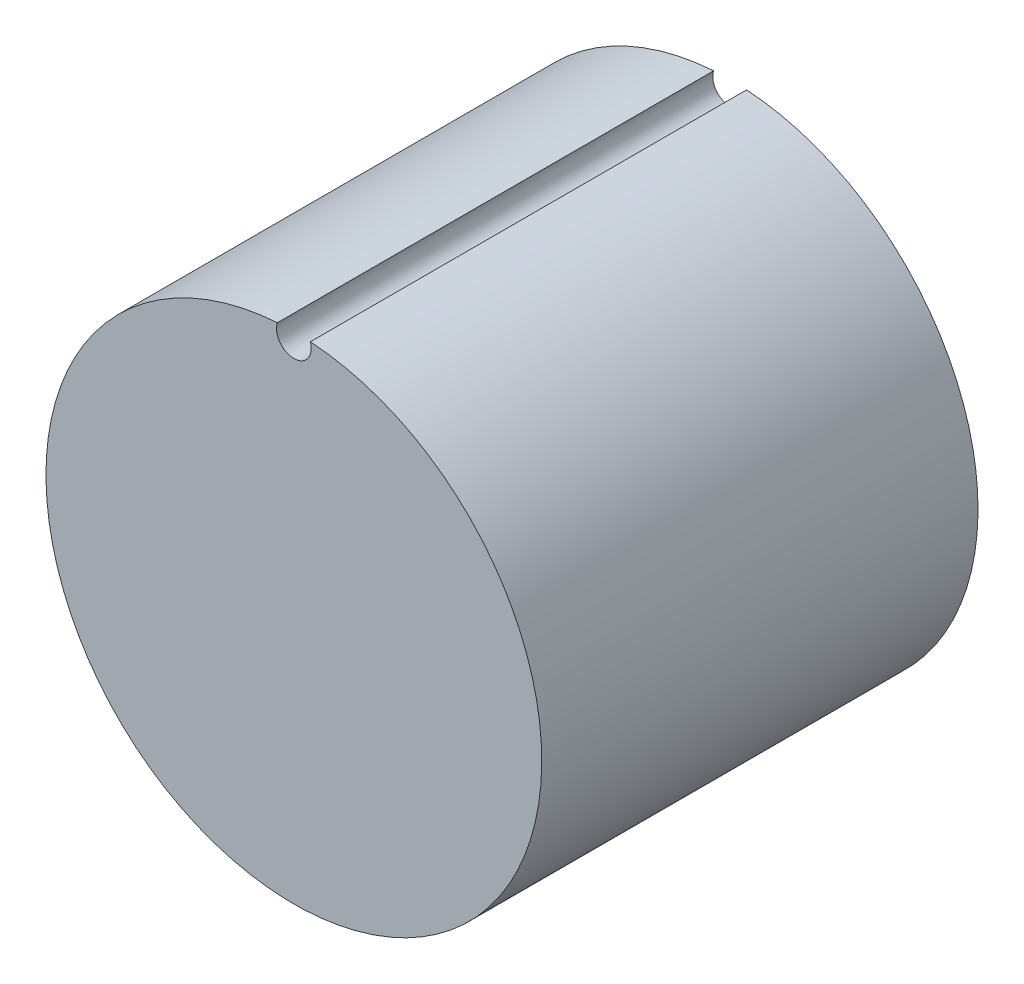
SolidWorks part; units mm, degrees
ref_plane "Ebene vorne" through (0, 0, 0) normal (0, 0, 1) x (1, 0, 0)
ref_plane "Ebene oben" through (0, 0, 0) normal (0, 1, 0) x (1, 0, 0)
ref_plane "Ebene rechts" through (0, 0, 0) normal (1, 0, 0) x (0, 0, -1)
sketch "Skizze1" plane through (0, 0, 0) normal (0, 0, 1) x (1, 0, 0)
  circle A0 centre (0, 0) radius 12.5
  dimension "D2" = 25
extrude "Aufsatz-Linear austragen2" add sketch "Skizze1" along normal blind 22
sketch "Skizze2" plane through (0, 0, 0) normal (0, 0, -1) x (-1, 0, 0)
  circle A0 centre (0, 0) radius 3
  dimension "D1" = 6
extrude "Schnitt-Linear austragen1" cut sketch "Skizze2" against normal blind 19 contours A0
sketch "Skizze5" plane through (0, 0, 0) normal (0, 0, -1) x (-1, 0, 0)
  circle A0 centre (0, 0) radius 8.5
  dimension "D1" = 17
extrude "Schnitt-Linear austragen3" cut sketch "Skizze5" against normal blind 7
sketch "Skizze7" plane through (0, 0, 22) normal (0, 0, 1) x (1, 0, 0)
  line L0 (0, 0) -> (0, 18.6406) construction
  circle A0 centre (0, 12.2) radius 0.875
  point P6 (0, 0)
  point P8 (0, 0)
  point P9 (0, 0)
  dimension "D1" = 1.75
extrude "Schnitt-Linear austragen5" cut sketch "Skizze7" against normal blind 22
